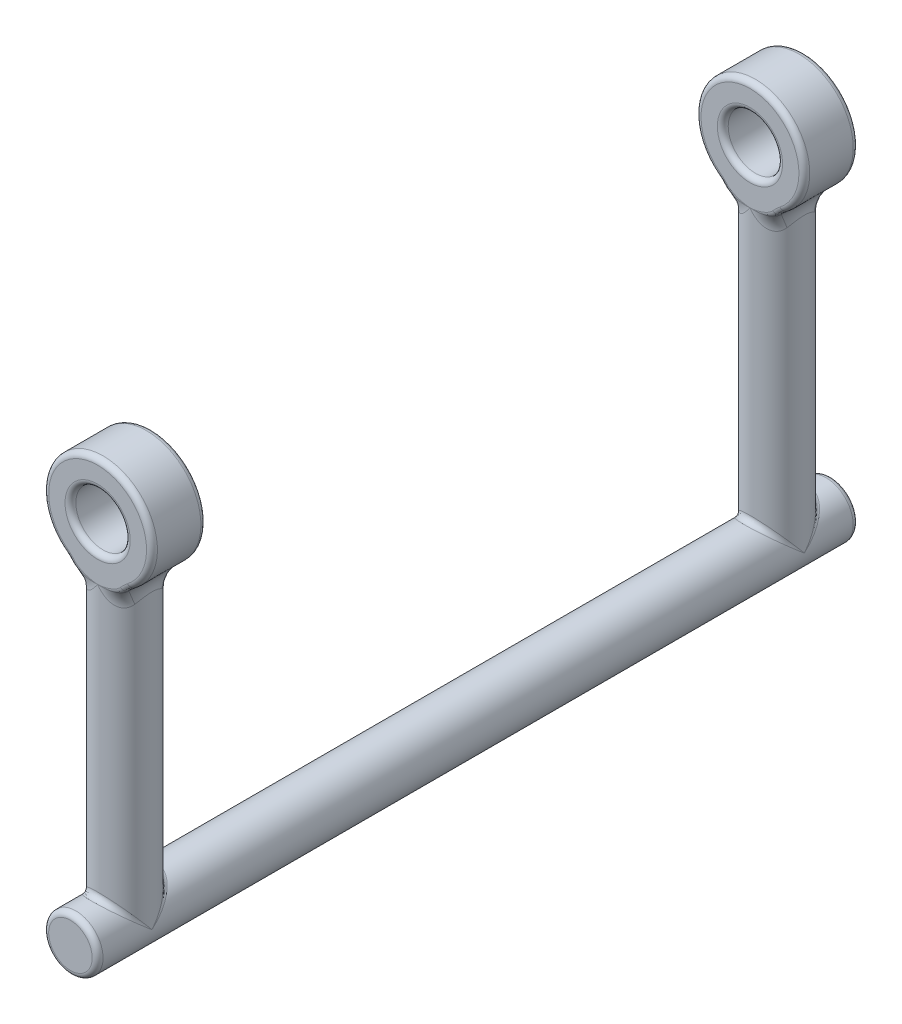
SolidWorks part; units mm, degrees
ref_plane "Front Plane" through (0, 0, 0) normal (0, 0, 1) x (1, 0, 0)
ref_plane "Top Plane" through (0, 0, 0) normal (0, 1, 0) x (1, 0, 0)
ref_plane "Right Plane" through (0, 0, 0) normal (1, 0, 0) x (0, 0, -1)
sketch "Sketch1" plane through (0, 0, 0) normal (0, 0, 1) x (1, 0, 0)
  circle A0 centre (0, 0) radius 10
  dimension "D1" = 20
extrude "Boss-Extrude1" add sketch "Sketch1" along normal mid plane 280
sketch "Sketch2" plane through (0, 0, 0) normal (0, 1, 0) x (1, 0, 0)
  line L0 (0, 120) -> (0, -120) construction
  circle A0 centre (0, 120) radius 10
  circle A1 centre (0, -120) radius 10
  point P4 (0, 0)
  dimension "D1" = 20
  dimension "D2" = 240
extrude "Boss-Extrude2" add sketch "Sketch2" along normal blind 120
sketch "Sketch3" plane through (0, 0, 0) normal (0, 0, 1) x (1, 0, 0)
  line L0 (0, 130) -> (0, 0) construction
  line L3 (10, 120) -> (-10, 120) construction
  circle A0 centre (0, 130) radius 20
  circle A1 centre (0, 130) radius 10
  dimension "D1" = 40
  dimension "D2" = 20
extrude "Boss-Extrude3" add sketch "Sketch3" along normal mid plane 260
sketch "Sketch4" plane through (0, 0, 0) normal (1, 0, 0) x (0, 0, -1)
  line L0 (0, 225) -> (0, 0) construction
  line L1 (-110, 75) -> (110, 75)
  line L2 (-110, 75) -> (-110, 375)
  line L3 (-110, 375) -> (110, 375)
  line L4 (110, 75) -> (110, 375)
  line L5 (-110, 75) -> (110, 375) construction
  line L6 (-110, 375) -> (110, 75) construction
  line L7 (110, 110) -> (110, 10) construction
  point P0 (0, 225)
  dimension "D1" = 225
  dimension "D2" = 300
  dimension "D3" = 0
extrude "Cut-Extrude1" cut sketch "Sketch4" against normal through all and the other way through all
fillet "Fillet1" radius 10 4 edges at (-9.979, 112.6674, 120.6481) (-9.979, 112.6674, 120.6481) (-9.979, 112.6674, -119.3519) (-9.979, 112.6674, -119.3519)
fillet "Fillet2" radius 2 26 edges at (0, 10, 130) (0, 10, 110) (10, 0, -140) (6.0581, 110.9396, -130) (6.0581, 110.9396, 130) (10, 130, -130) (10, 130, 130) (-6.0581, 110.9396, -110) (-10, 130, -110) (6.0581, 110.9396, 110) (0, 120, 110) (10, 0, 140) (0, 150, 110) (0, 10, -110) (-6.0581, 110.9396, 110) (0, 150, 130) (-6.0581, 110.9396, 130) (13.3123, 115.0741, 121.123) (-13.3123, 115.0741, 118.877) (0, 10, -130) (0, 150, -110) (6.0581, 110.9396, -110) (0, 150, -130) (-6.0581, 110.9396, -130) (13.3123, 115.0741, -118.877) (-13.3123, 115.0741, -121.123)
